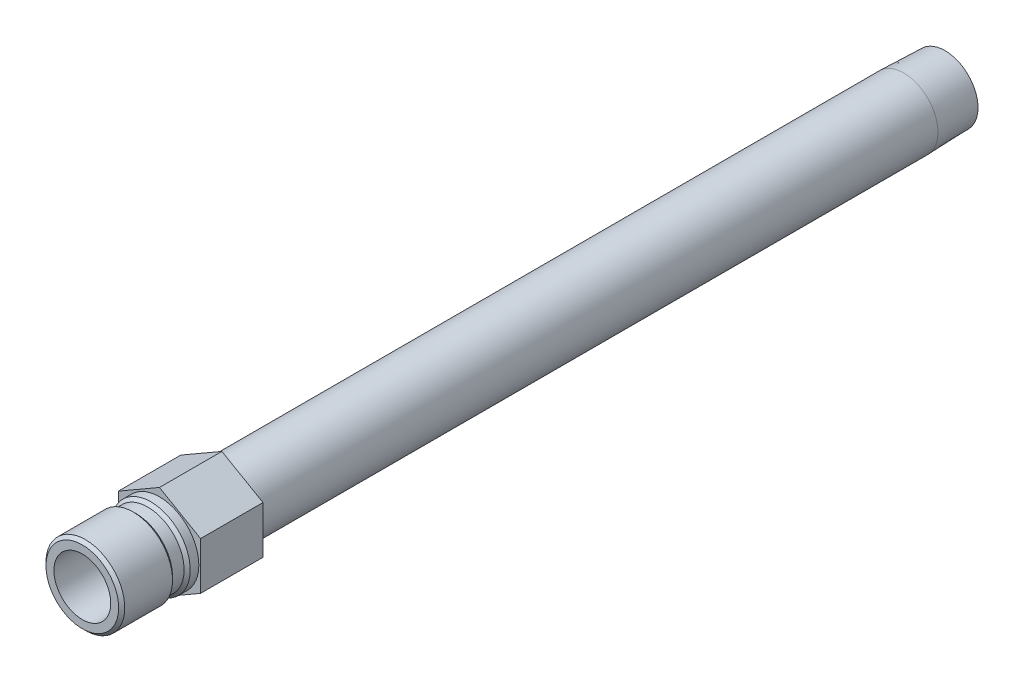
SolidWorks part; units mm, degrees
ref_plane "Front Plane" through (0, 0, 0) normal (0, 0, 1) x (1, 0, 0)
ref_plane "Top Plane" through (0, 0, 0) normal (0, 1, 0) x (1, 0, 0)
ref_plane "Right Plane" through (0, 0, 0) normal (1, 0, 0) x (0, 0, -1)
sketch "Sketch1" plane through (0, 0, 0) normal (1, 0, 0) x (0, 0, -1)
  line L0 (0, 0) -> (-22.479, 0) construction
  line L1 (-19.304, 7.112) -> (-19.304, 9.0932)
  line L2 (-5.8166, 9.0932) -> (-5.8166, 0) construction
  line L3 (-18.542, 9.8552) -> (-6.5786, 9.8552)
  line L4 (0, 8.5725) -> (0, 0) construction
  line L5 (-5.8166, 9.0932) -> (-2.921, 9.0932)
  line L6 (-2.159, 9.8552) -> (0, 9.8552)
  line L7 (0, 9.8552) -> (0, 8.5725)
  line L8 (-5.8166, 9.0932) -> (-6.5786, 9.8552)
  line L9 (-2.921, 9.0932) -> (-2.159, 9.8552)
  line L10 (-19.304, 9.0932) -> (-18.542, 9.8552)
  line L11 (-19.304, 7.112) -> (-1.524, 7.112)
  line L12 (0, 8.5725) -> (186.2582, 8.5725)
  line L13 (186.2582, 8.5725) -> (196.596, 8.2494)
  line L14 (196.596, 8.2494) -> (196.596, 6.2611)
  line L15 (0, 9.8552) -> (15.621, 9.8552) construction
  line L16 (15.621, 9.8552) -> (15.621, 0) construction
  line L17 (15.621, 0) -> (0, 0) construction
  line L18 (-1.0716, 6.2611) -> (-1.524, 7.112)
  line L19 (-1.0716, 6.2611) -> (196.596, 6.2611)
  dimension "D1" = 19.304
  dimension "D2" = 2.8956
  dimension "D3" = 0.762
  dimension "D4" = 45
  dimension "D5" = 13.4874
  dimension "D6" = 45
  dimension "D7" = 1.79
  dimension "D8" = 10.3378
  dimension "D9" = 215.9
  dimension "D10" = 3.175
  dimension "D11" = 34.925
  dimension "D12" = 14.224
  dimension "D13" = 17.145
  dimension "D14" = 19.7104
  dimension "D15" = 12.5222
  dimension "D16" = 118
  dimension "D17" = 17.78
revolve "Revolve1" add sketch "Sketch1" angle 360 about L0
sketch "Sketch2" plane through (0, 0, 0) normal (0, 0, 1) x (1, 0, 0)
  line L1 (-10.287, 5.9392) -> (-10.287, -5.9392)
  line L2 (-10.287, -5.9392) -> (0, -11.8784)
  line L3 (0, -11.8784) -> (10.287, -5.9392)
  line L4 (10.287, -5.9392) -> (10.287, 5.9392)
  line L5 (10.287, 5.9392) -> (0, 11.8784)
  line L6 (0, 11.8784) -> (-10.287, 5.9392)
  circle A0 centre (0, 0) radius 10.287 construction
  circle A1 centre (0, 0) radius 7.112 construction
  circle A2 centre (0, 0) radius 7.112
  dimension "D1" = 20.574
extrude "Boss-Extrude1" add sketch "Sketch2" against normal up to vertex (15.621 mm away) from vertex at 0
